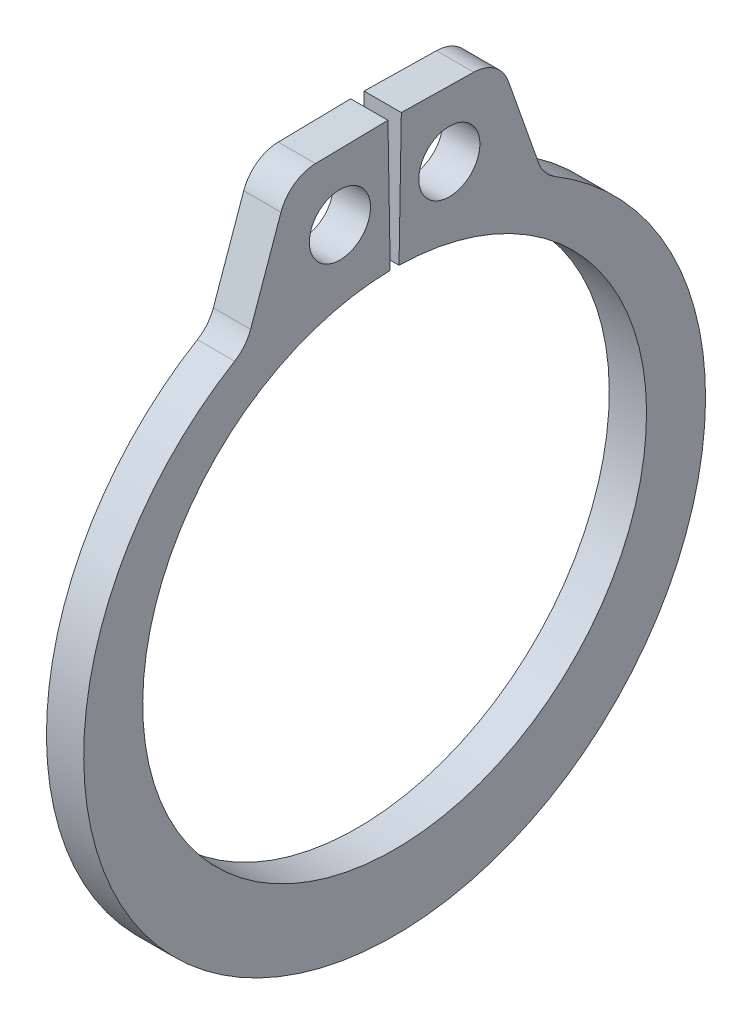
SolidWorks part; units mm, degrees
ref_plane "Front" through (0, 0, 0) normal (0, 0, 1) x (1, 0, 0)
ref_plane "Top" through (0, 0, 0) normal (0, 1, 0) x (1, 0, 0)
ref_plane "Right" through (0, 0, 0) normal (1, 0, 0) x (0, 0, -1)
sketch "Sketch1" plane through (0, 0, 0) normal (1, 0, 0) x (0, 0, -1)
  line L0 (0, 0) -> (0, 4.2926) construction
  line L1 (-0.0749, 4.2919) -> (-0.1139, 6.5268)
  line L2 (0.1139, 6.5268) -> (1.7901, 6.4975)
  line L3 (1.7901, 6.4975) -> (2.5323, 4.3892)
  line L4 (0.0749, 4.2919) -> (0.1139, 6.5268)
  line L5 (-0.1139, 6.5268) -> (-1.7901, 6.4975)
  line L6 (-1.7901, 6.4975) -> (-2.5323, 4.3892)
  line L7 (-2.5323, 4.3892) -> (-2.1452, 3.7182) construction
  line L8 (2.5323, 4.3892) -> (2.1452, 3.7182) construction
  line L9 (0, -4.2926) -> (0, -5.5626) construction
  line L10 (-1.7901, 6.4975) -> (-0.0749, 4.2919) construction
  line L11 (0, 4.2926) -> (0, 6.5278) construction
  line L12 (-4.2926, 0) -> (4.2926, 0) construction
  circle A0 centre (0, 0) radius 4.2926 construction
  arc A1 (-0.0749, 4.2919) -> (0.0749, 4.2919) centre (0, 0) ccw
  circle A3 centre (0, 0) radius 7.747 construction
  circle A4 centre (-0.9325, 5.3947) radius 0.5207
  circle A5 centre (0.9325, 5.3947) radius 0.5207
  arc A6 (-2.5323, 4.3892) -> (2.5323, 4.3892) centre (0, -0.2645) ccw
  point P0 (0, -5.5626)
extrude "Extrude1" add sketch "Sketch1" along normal mid plane 0.635
fillet "Fillet1" radius 0.635 4 edges at (0, 4.3892, 2.5323) (0, 4.3892, -2.5323) (0, 6.4975, 1.7901) (0, 6.4975, -1.7901)
sketch "Sketch2" plane through (0, 0, 0) normal (0, 0, 1) x (1, 0, 0)
  line L0 (-3.5433, 0) -> (9.1567, 0)
  line L1 (9.1567, 0) -> (9.1567, -4.7625)
  line L2 (-3.5433, 0) -> (-3.5433, -4.4704)
  line L3 (9.1567, -4.7625) -> (0.3683, -4.7625)
  line L4 (0.3683, -4.7625) -> (0.3683, -4.4704)
  line L5 (0.3683, -4.4704) -> (-0.3683, -4.4704)
  line L6 (-0.3683, -4.4704) -> (-0.3683, -4.7625)
  line L7 (-0.3683, -4.7625) -> (-3.5433, -4.7625) construction
  line L8 (-3.5433, -4.7625) -> (-3.5433, 0) construction
  line L9 (9.1567, 0) -> (76.391, 0) construction
  line L10 (0, -4.4704) -> (0, 0) construction
  line L11 (-3.5433, -4.4704) -> (-3.2512, -4.7625)
  line L12 (-3.2512, -4.7625) -> (-0.3683, -4.7625)
revolve "Revolve1" [suppressed] add sketch "Sketch2" angle 360 about L9
delete or keep bodies "Body-Delete1" [suppressed] type delete bodies bodies 122
equation "\"D2@Sketch2\" = \"D1@Extrude1\"*20"
equation "\"D3@Sketch2\" = \"D2@Sketch2\"/4"
equation "\"D2@Sketch1\" = \"H@Sketch1\"*.75"
equation "\"D1@Fillet1\" = \"D1@Extrude1\""
